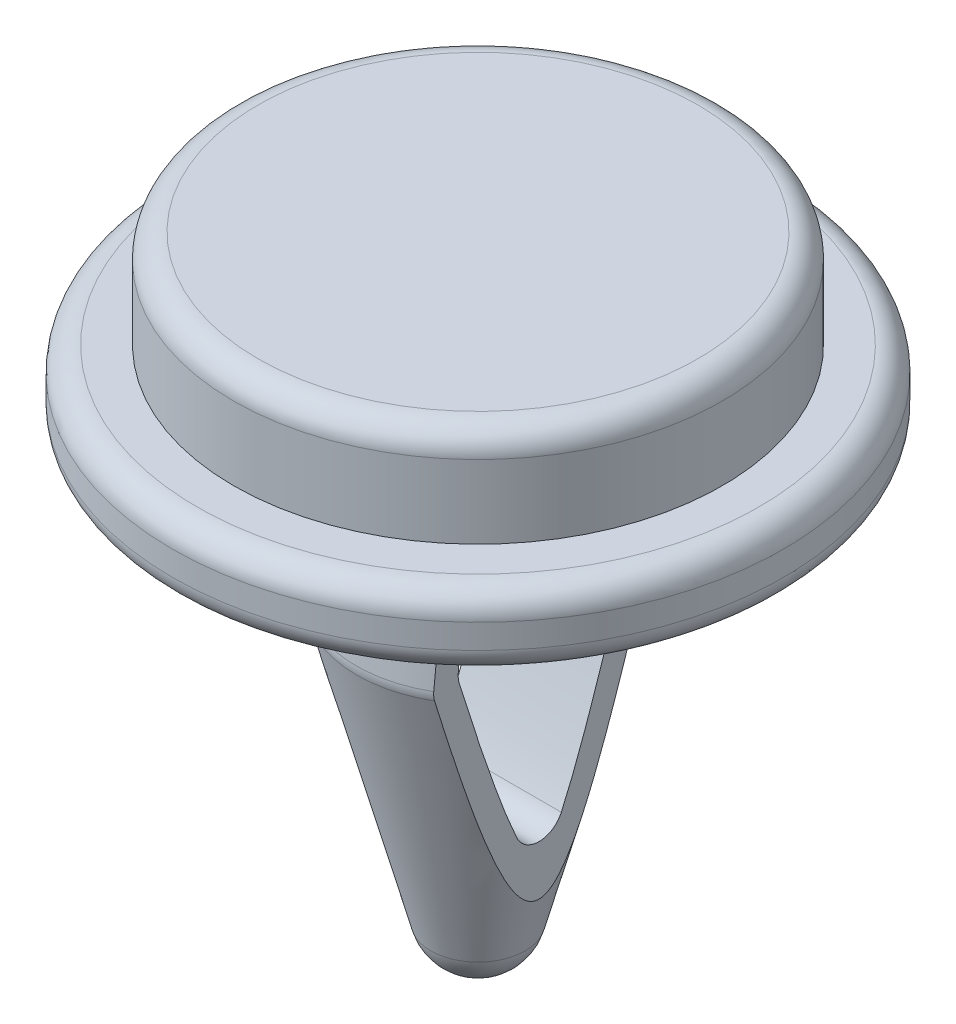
SolidWorks part; units mm, degrees
ref_plane "Front Plane" through (0, 0, 0) normal (0, 0, 1) x (1, 0, 0)
ref_plane "Top Plane" through (0, 0, 0) normal (0, 1, 0) x (1, 0, 0)
ref_plane "Right Plane" through (0, 0, 0) normal (1, 0, 0) x (0, 0, -1)
sketch "Sketch1" plane through (0, 0, 0) normal (0, 0, 1) x (1, 0, 0)
  line L0 (0, 0) -> (0, -15.6223) construction
  line L1 (0, 3.5) -> (5, 3.5)
  line L2 (5, 3.5) -> (5, 1.5)
  line L3 (5, 1.5) -> (6.25, 1.5)
  line L4 (6.25, 1.5) -> (6.25, 0)
  line L5 (6.25, 0) -> (2.2346, 0)
  line L6 (2.2346, 0) -> (2.5, -3.0336)
  line L7 (2.5, -3.0336) -> (0.9659, -8.7588)
  line L8 (0, 3.5) -> (0, -9.5)
  arc A0 (0.9659, -8.7588) -> (0, -9.5) centre (0, -8.5) cw
  dimension "D9" = 1
  dimension "D1" = 10
  dimension "D2" = 2
  dimension "D3" = 12.5
  dimension "D4" = 3.5
  dimension "D5" = 9.5
  dimension "D6" = 5
  dimension "D8" = 15
  dimension "D7" = 85
revolve "Revolve1" add sketch "Sketch1" angle 360 about L0
sketch "Sketch2" plane through (0, 0, 0) normal (0, 0, 1) x (1, 0, 0)
  line L0 (0, 0) -> (0, -10.0413) construction
  line L2 (-4.7977, 0) -> (-1.25, 0)
  line L3 (-4.7977, 0) -> (-4.7977, -10.0413)
  line L4 (-4.7977, -10.0413) -> (-1.25, -10.0413)
  line L5 (-1.25, 0) -> (-1.25, -10.0413)
  line L6 (1.25, 0) -> (1.25, -10.0413)
  line L7 (4.7977, -10.0413) -> (1.25, -10.0413)
  line L8 (4.7977, 0) -> (4.7977, -10.0413)
  line L9 (4.7977, 0) -> (1.25, 0)
  line L10 (-6.25, 0) -> (6.25, 0) construction
  dimension "D1" = 2.5
extrude "Cut-Extrude1" cut sketch "Sketch2" against normal mid plane 11.4745
sketch "Sketch3" plane through (1.25, 0, 0) normal (1, 0, 0) x (0, 0, -1)
  line L3 (1.4021, -0.5) -> (-1.4021, -0.5)
  line L4 (1.0394, -0.5) -> (-1.0394, -0.5)
  arc A0 (0.4549, -6.3871) -> (-0.4549, -6.3871) centre (0, -6.1796) cw
  arc A1 (1.6334, -3.0601) -> (1.655, -2.8819) centre (1.1559, -2.9117) ccw
  arc A2 (-1.6334, -3.0601) -> (-1.655, -2.8819) centre (-1.1559, -2.9117) cw
  arc A3 (-1.0394, -0.5) -> (-1.5384, -0.9689) centre (-1.0394, -1) ccw
  arc A4 (1.0394, -0.5) -> (1.5384, -0.9689) centre (1.0394, -1) cw
  spline S9 degree 3 poles (1900.5006, -627.1403) (-28.7411, 92.9218) (13.0983, 28.6687) (0.8023, -5.5442) (0.6635, -5.9156) (0.4311, -6.4431) (0.3485, -6.6185) (0.2201, -6.8536) (0.1762, -6.9272) (0.1077, -7.0289) (0.0839, -7.0621) (-3.4183, -11.5705) (28.0083, 95.3244) (1666.7454, 1096.5496) knots -22.079978 -22.079978 -22.079978 -22.079978 0.5 0.5 0.75 0.75 0.875 0.875 0.9375 0.9375 0.96875 0.96875 5.889395 5.889395 5.889395 5.889395 only from (1.6874, -2.8858) to (0.0001, -7.1623)
  spline S10 degree 3 poles (1982.9692, 128.7015) (58.1522, 238.7946) (11.1245, 120.5428) (-1.4811, -1.2589) (-1.5073, -1.5119) (-1.5333, -1.7648) (-1.5592, -2.0178) (-14.4581, -128.0164) (5.3687, -257.3728) (-1982.6657, -160.6376) knots -0.366594 -0.366594 -0.366594 -0.366594 0.000763 0.000763 0.000763 0.001526 0.001526 0.001526 0.381497 0.381497 0.381497 0.381497 only from (-1.4021, -0.5) to (-1.6574, -2.9827)
  spline S11 degree 3 poles (-1928.8259, -534.0902) (31.2746, 81.2396) (-13.0583, 28.7174) (-0.8256, -5.481) (-0.695, -5.8337) (-0.4727, -6.3517) (-0.3947, -6.5228) (-0.2648, -6.774) (-0.2189, -6.8566) (2.3251, -10.8924) (9.0226, -12.0178) (1666.2337, 1098.3776) knots -23.381841 -23.381841 -23.381841 -23.381841 0.5 0.5 0.75 0.75 0.875 0.875 0.9375 0.9375 4.046519 4.046519 4.046519 4.046519 only from (-1.6574, -2.9827) to (0.0001, -7.1623)
  spline S12 degree 3 poles (1982.6244, -161.7191) (-4.2859, -257.3197) (14.437, -128.1566) (1.5803, -2.2237) (1.5544, -1.9706) (1.5285, -1.7176) (1.5024, -1.4647) (-11.072, 120.4074) (-57.0662, 238.8473) (-1982.9494, 129.9183) knots -0.379 -0.379 -0.379 -0.379 0.000763 0.000763 0.000763 0.001526 0.001526 0.001526 0.369083 0.369083 0.369083 0.369083 only from (1.6574, -2.9827) to (1.4021, -0.5)
  spline S13 degree 3 poles (-1.5384, -0.9689) (-1.5443, -1.063) (-1.5502, -1.157) (-1.556, -1.2511) (-1.5717, -1.5052) (-1.5873, -1.7593) (-1.6027, -2.0134) (-1.6203, -2.3029) (-1.6377, -2.5924) (-1.655, -2.8819) knots 0.00048 0.00048 0.00048 0.00048 0.000763 0.000763 0.000763 0.001526 0.001526 0.001526 0.002395 0.002395 0.002395 0.002395
  spline S14 degree 3 poles (-1.6334, -3.0601) (-1.418, -3.7528) (-1.1967, -4.4436) (-0.8256, -5.481) (-0.695, -5.8337) (-0.5169, -6.2487) (-0.4864, -6.3181) (-0.4549, -6.3871) knots 0.017941 0.017941 0.017941 0.017941 0.5 0.5 0.75 0.75 0.800431 0.800431 0.800431 0.800431
  spline S15 degree 3 poles (1.655, -2.8819) (1.6418, -2.6613) (1.6286, -2.4407) (1.6152, -2.2201) (1.5999, -1.966) (1.5844, -1.7119) (1.5687, -1.4578) (1.5587, -1.2948) (1.5486, -1.1319) (1.5384, -0.9689) knots 0.000101 0.000101 0.000101 0.000101 0.000763 0.000763 0.000763 0.001526 0.001526 0.001526 0.002015 0.002015 0.002015 0.002015
  spline S16 degree 3 poles (1.6334, -3.0601) (1.4123, -3.7713) (1.1859, -4.4768) (0.8023, -5.5442) (0.6635, -5.9156) (0.491, -6.3073) (0.473, -6.3473) (0.4549, -6.3871) knots 0.037735 0.037735 0.037735 0.037735 0.5 0.5 0.75 0.75 0.77848 0.77848 0.77848 0.77848
  dimension "D3" = 0.5
  dimension "D1" = 0.5
  dimension "D2" = 0.5
extrude "Cut-Extrude2" cut sketch "Sketch3" against normal through all
fillet "Fillet1" radius 0.5 9 edges at (0, 0, -2.2346) (0, 0, 2.2346) (0, -3.0336, -2.5) (0, -3.0336, 2.5) (-1.25, 0, 0) (1.25, 0, 0) (0, 0, 6.25) (0, 1.5, 6.25) (0, 3.5, 5)
